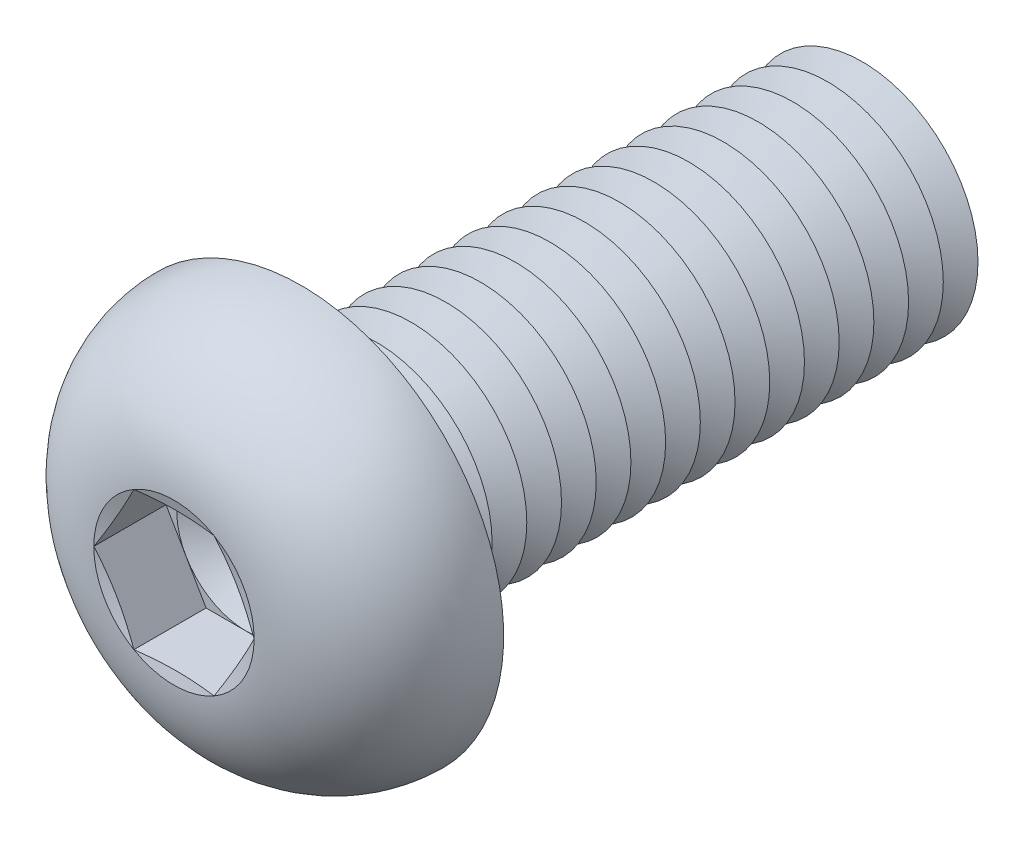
SolidWorks part; units mm, degrees
ref_plane "Front Plane" through (0, 0, 0) normal (0, 0, 1) x (1, 0, 0)
ref_plane "Top Plane" through (0, 0, 0) normal (0, 1, 0) x (1, 0, 0)
ref_plane "Right Plane" through (0, 0, 0) normal (1, 0, 0) x (0, 0, -1)
sketch "Sketch1" plane through (0, 0, 0) normal (1, 0, 0) x (0, 0, -1)
  line L0 (0, 5) -> (0, 8.75)
  line L3 (0, 5) -> (25, 5)
  line L4 (25, 5) -> (25, 0)
  line L5 (25, 0) -> (-5.5, 0) construction
  line L6 (-5.5, 0) -> (25, 0)
  line L7 (-5.5, 3.4641) -> (-5.5, 1.732) construction
  line L8 (-5.5, 1.732) -> (-5.5, 0)
  line L9 (-5.5, 3.4641) -> (-5.0359, 1.732)
  line L10 (-5.0359, 1.732) -> (-5.5, 1.732)
  line L11 (25, 0) -> (22.7481, 0) construction
  line L12 (0, 8.75) -> (-5.5, 8.75) construction
  arc A1 (0, 8.75) -> (-5.5, 3.4641) centre (0, 3.2457) ccw
  point P8 (25, 2.5)
  dimension "D1" = 17.5
  dimension "D2" = 10
  dimension "D3" = 5.5
  dimension "D4" = 6.9282
  dimension "D5" = 25
  dimension "D6" = 15
revolve "Revolve1" add sketch "Sketch1" angle 360 about L5
fillet "Fillet1" radius 0.75 1 edges at (-5, 0, 0)
sketch "Sketch2" plane through (0, 0, 0) normal (1, 0, 0) x (0, 0, -1)
  line L0 (24.25, 5) -> (25.75, 5)
  line L1 (25, 5) -> (0.75, 5) construction
  line L2 (25.75, 5) -> (25, 3.701)
  line L3 (25, -5) -> (25, 5) construction
  line L4 (25, 3.701) -> (24.25, 5)
  dimension "D1" = 1.5
revolve "Cut-Revolve1" cut sketch "Sketch2" angle 360 about axis through (0, 0, -25) along (0, 0, -1)
pattern_linear "LPattern1" count 16 spacing 1.5 along (0, 0, 1) of "Cut-Revolve1"
sketch "Sketch3" plane through (0, 0, 5.5) normal (0, 0, 1) x (1, 0, 0)
  line L7 (1.732, 3) -> (-1.7321, 3)
  line L8 (-1.7321, 3) -> (-3.4641, 0)
  line L9 (-3.4641, 0) -> (-1.732, -3)
  line L10 (-1.732, -3) -> (1.732, -3)
  line L11 (1.732, -3) -> (3.4641, 0)
  line L12 (3.4641, 0) -> (1.732, 3)
  circle A0 centre (0, 0) radius 3 construction
  circle A3 centre (0, 0) radius 3.4641 construction
extrude "Cut-Extrude1" cut sketch "Sketch3" against normal blind 3.12
sketch "Sketch4" plane through (0, 0, 2.38) normal (0, 0, 1) x (1, 0, 0)
  line L1 (1.732, 3) -> (-1.7321, 3) construction
  circle A0 centre (0, 0) radius 3
extrude "Cut-Extrude2" cut sketch "Sketch4" against normal through all draft 60
